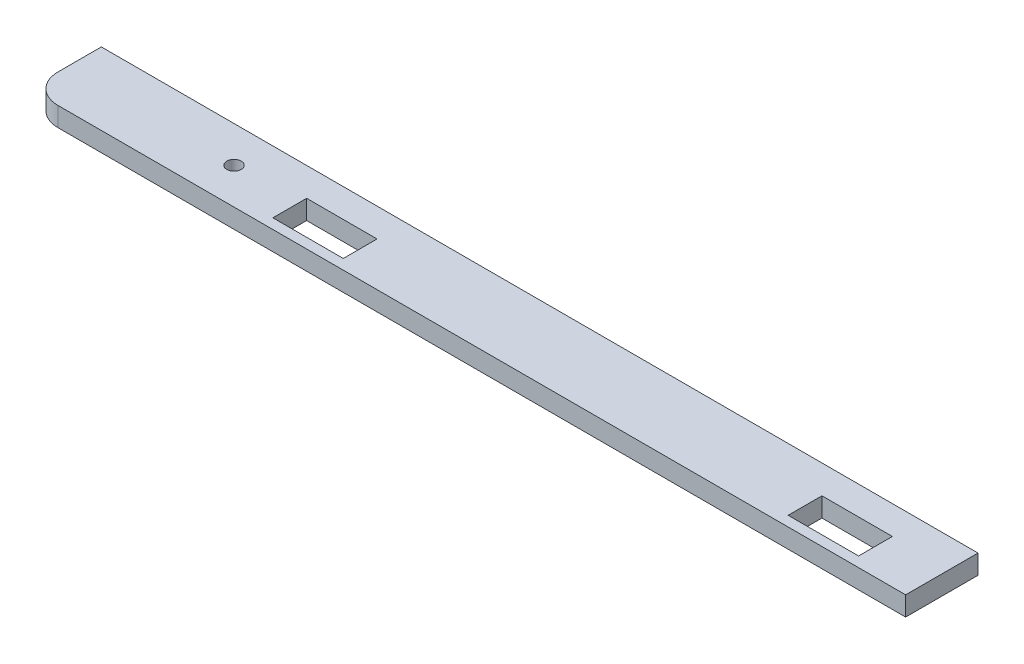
SolidWorks part; units mm, degrees
ref_plane "Front" through (0, 0, 0) normal (0, 0, 1) x (1, 0, 0)
ref_plane "Top" through (0, 0, 0) normal (0, 1, 0) x (1, 0, 0)
ref_plane "Right" through (0, 0, 0) normal (1, 0, 0) x (0, 0, -1)
ref_plane "Plane1" through (0, 3, 0) normal (0, 1, 0) x (1, 0, 0)
sketch "Sketch1" plane through (0, 3, 0) normal (0, 1, 0) x (1, 0, 0)
  line L0 (-105.85, -121) -> (75.85, -121)
  line L1 (75.85, -121) -> (75.85, -106)
  line L2 (75.85, -106) -> (-105.85, -106)
  line L3 (-105.85, -106) -> (-105.85, -121)
  circle A0 centre (-70.85, -113.5) radius 1.5
  dimension "D7" = 3
  dimension "D3" = 121
  dimension "D5" = 7.5
extrude "Boss-Extrude1" add sketch "Sketch1" against normal blind 4
sketch "Sketch4" plane through (0, 3, 0) normal (0, 1, 0) x (-1, 0, 0)
  line L0 (-57.4019, 113.9) -> (-53.4, 113.9)
  line L1 (-53.4, 116.9) -> (-57.4019, 116.9)
  line L3 (-49.4, 111.9) -> (-64, 111.9)
  line L4 (-49.4, 111.9) -> (-49.4, 118.9)
  line L5 (-49.4, 118.9) -> (-64, 118.9)
  line L6 (-64, 111.9) -> (-64, 118.9)
  arc A0 (-57.4019, 116.9) -> (-57.4019, 113.9) centre (-60, 115.4) cw
  arc A1 (-53.4, 113.9) -> (-53.4, 116.9) centre (-53.4, 115.4) ccw
  dimension "D1" = 2
  dimension "D2" = 2
  dimension "D3" = 4
  dimension "D4" = 4
extrude "Cut-Extrude3" cut sketch "Sketch4" against normal through all
sketch "Sketch5" plane through (0, -1, 0) normal (0, -1, 0) x (1, 0, 0)
  line L0 (-53.4, 113.9) -> (-49.3981, 113.9)
  line L1 (-49.3981, 116.9) -> (-53.4, 116.9)
  line L3 (-57.4, 111.9) -> (-42.8, 111.9)
  line L4 (-57.4, 111.9) -> (-57.4, 118.9)
  line L5 (-57.4, 118.9) -> (-42.8, 118.9)
  line L6 (-42.8, 111.9) -> (-42.8, 118.9)
  arc A0 (-53.4, 116.9) -> (-53.4, 113.9) centre (-53.4, 115.4) ccw
  arc A1 (-49.3981, 113.9) -> (-49.3981, 116.9) centre (-46.8, 115.4) cw
  dimension "D1" = 4
  dimension "D4" = 4
  dimension "D2" = 2
  dimension "D3" = 2
extrude "Cut-Extrude4" cut sketch "Sketch5" against normal through all
fillet "Fillet1" radius 6 1 edges at (-105.85, 1, 121)
